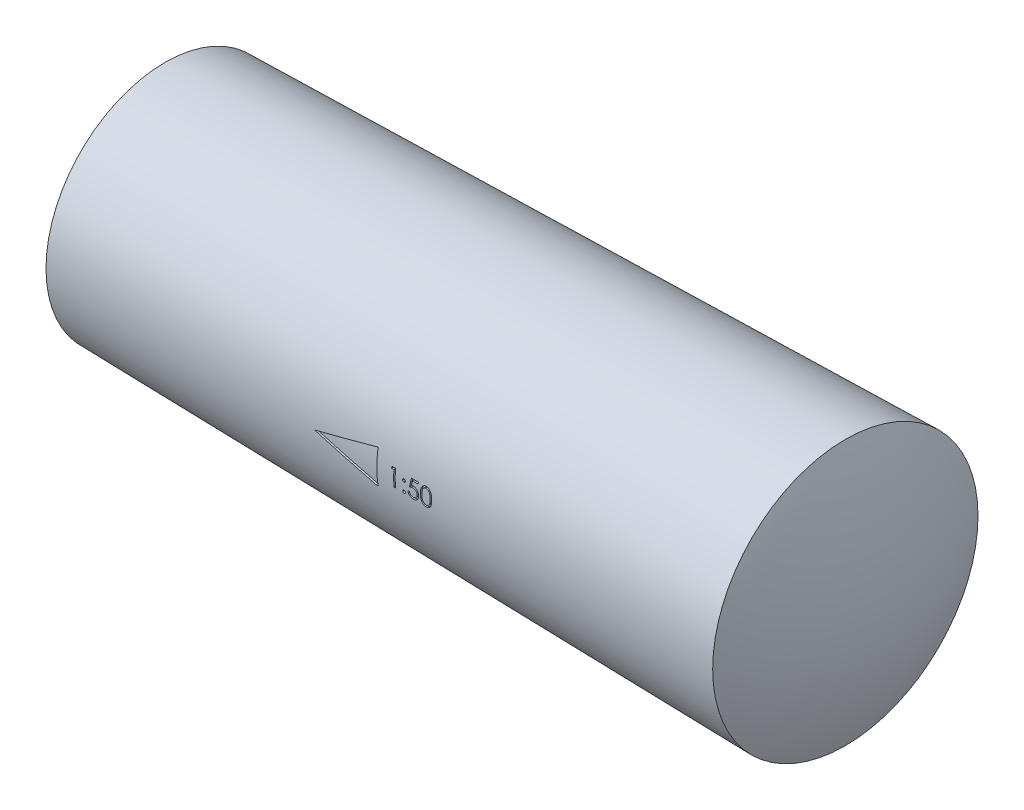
SolidWorks part; units mm, degrees
ref_plane "Front Plane" through (0, 0, 0) normal (0, 0, 1) x (1, 0, 0)
ref_plane "Top Plane" through (0, 0, 0) normal (0, 1, 0) x (1, 0, 0)
ref_plane "Right Plane" through (0, 0, 0) normal (1, 0, 0) x (0, 0, -1)
sketch "Sketch1" plane through (0, 0, 0) normal (1, 0, 0) x (0, 0, -1)
  circle A0 centre (0, 0) radius 7
  dimension "D1" = 14
extrude "Extrude1" add sketch "Sketch1" along normal mid plane 40
draft "Draft1" type of draft neutral plane draft angle 1.146 faces to draft 1 parameters "D1"=1.146
sketch "Sketch2" plane through (0, 0, 0) normal (0, 0, 1) x (1, 0, 0)
  line L0 (-20, 0) -> (-20, 7)
  line L1 (-20, 7) -> (-20, -7) construction
  line L2 (-20, 0) -> (-21.6, 0)
  line L3 (-21.6, 0) -> (-21.6, -7.4) construction
  line L4 (20, 0) -> (20, 7.8)
  line L5 (20, -7.8) -> (20, 7.8) construction
  line L6 (20, 0) -> (21.6, 0)
  line L7 (21.6, 0) -> (21.6, -7.4) construction
  line L8 (-20, -7) -> (20, -7.8) construction
  arc A0 (-21.6, 0) -> (-20, 7) centre (-5.4875, 0) cw
  arc A1 (21.6, 0) -> (20, 7.8) centre (1.7874, 0) ccw
  point P14 (0, -7.4)
revolve "Revolve1" add sketch "Sketch2" angle 360 about L2
sketch "Sketch5" plane through (0, 0, 0) normal (0, 0, 1) x (1, 0, 0)
  line L0 (0, 7.4) -> (0, -7.4) construction
  line L1 (20, 7.8) -> (-20, 7) construction
  line L2 (-20, -7) -> (20, -7.8) construction
ref_plane "Plane2" through (0, 0, 0) normal (-0.02, 0, 0.9998) x (0.9998, 0, 0.02)
sketch "Sketch6" plane through (0, 0, 0) normal (-0.02, 0, 0.9998) x (0.9998, 0, 0.02)
  line L0 (0, 0) -> (0, 1)
  line L1 (0, 7.4) -> (0, -7.4) construction
  line L2 (0, 1) -> (-3.7321, 0)
  line L3 (-3.7321, 0) -> (0, -1)
  line L4 (0, -1) -> (0, 0)
  line L5 (0, -0.5) -> (4, -0.5) construction
  text T0 "1:50" font "Century Gothic" height 1
  dimension "D1" = 2
  dimension "D2" = 30
  dimension "D3" = 4
wrap "Wrap2" sketch "Sketch6" wrap type deboss source sketch "Sketch6" thickness 0.1 parameters "D1"=0.1
equation "\"D2@Sketch2\" = \"D1@Sketch2\""
